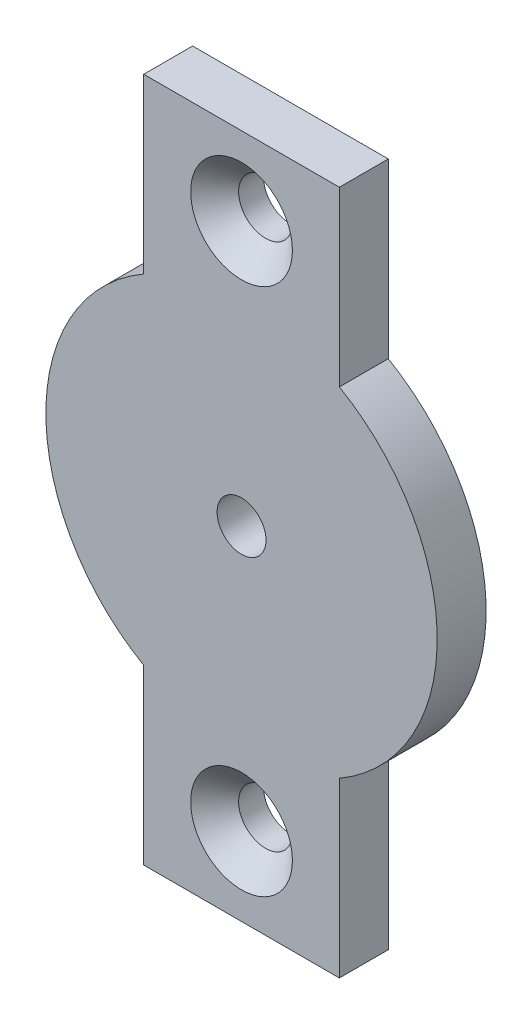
SolidWorks part; units mm, degrees
ref_plane "Front Plane" through (0, 0, 0) normal (0, 0, 1) x (1, 0, 0)
ref_plane "Top Plane" through (0, 0, 0) normal (0, 1, 0) x (1, 0, 0)
ref_plane "Right Plane" through (0, 0, 0) normal (1, 0, 0) x (0, 0, -1)
sketch "Sketch1" plane through (0, 0, 0) normal (0, 0, 1) x (1, 0, 0)
  circle A0 centre (0, 0) radius 20
  dimension "D1" = 40
extrude "Boss-Extrude1" add sketch "Sketch1" along normal blind 5
sketch "Sketch2" plane through (0, 0, 5) normal (0, 0, 1) x (1, 0, 0)
  line L0 (0, 0) -> (0, 35) construction
  line L1 (-10, 35) -> (10, 35)
  line L2 (10, 35) -> (10, 17.3205)
  line L3 (10, 17.3205) -> (-10, 17.3205)
  line L4 (-10, 17.3205) -> (-10, 35)
  circle A0 centre (0, 0) radius 20 construction
  point P6 (0, 35)
  dimension "D1" = 35
  dimension "D2" = 20
extrude "Boss-Extrude2" add sketch "Sketch2" against normal blind 5
ref_plane "Plane1" through (0, 0, 0) normal (0, 1, 0) x (1, 0, 0)
mirror "Mirror1" about plane through (0, 0, 0) normal (0, 1, 0) of "Boss-Extrude2"
sketch "Sketch3" plane through (0, 0, 5) normal (0, 0, 1) x (1, 0, 0)
  circle A0 centre (0, 0) radius 2.5
  dimension "D1" = 5
extrude "Cut-Extrude1" cut sketch "Sketch3" against normal blind 10 contours A0
sketch "Sketch4" plane through (0, 0, 5) normal (0, 0, 1) x (1, 0, 0)
  line L0 (0, -35) -> (0, -27) construction
  line L1 (10, -35) -> (-10, -35) construction
  line L2 (0, 35) -> (0, 27) construction
  line L3 (10, 35) -> (-10, 35) construction
  dimension "D1" = 8
  dimension "D2" = 8
hole_wizard "CSK for M5 Countersunk Flat Head Screw1" positions "3DSketch1" profile "Sketch5" countersink size "M5" standard "ISO"
sketch3d "3DSketch1"
  point P0 (0, -27, 5)
  point P3 (0, 27, 5)
sketch "Sketch5" plane through (0, -27, 5) normal (1, 0, 0) x (0, -1, 0)
  line L0 (0, 0) -> (0, 8.6524)
  line L1 (0, 8.6524) -> (2.75, 7)
  line L2 (2.75, 7) -> (2.75, 2.45)
  line L3 (2.75, 2.45) -> (5.2, 0)
  line L5 (5.2, 0) -> (0, 0)
  line L6 (-2.75, 2.45) -> (-5.2, 0) construction
  line L10 (0, 8.6524) -> (-2.75, 7) construction
  line L11 (0, -6.35) -> (0, 107.95) construction
  dimension "Hole Dia." = 5.5
  dimension "Hole Depth" = 7
  dimension "Near C'Sink Dia." = 10.4
  dimension "Near C'Sink Angle" = 90
  dimension "Drill Angle" = 118
